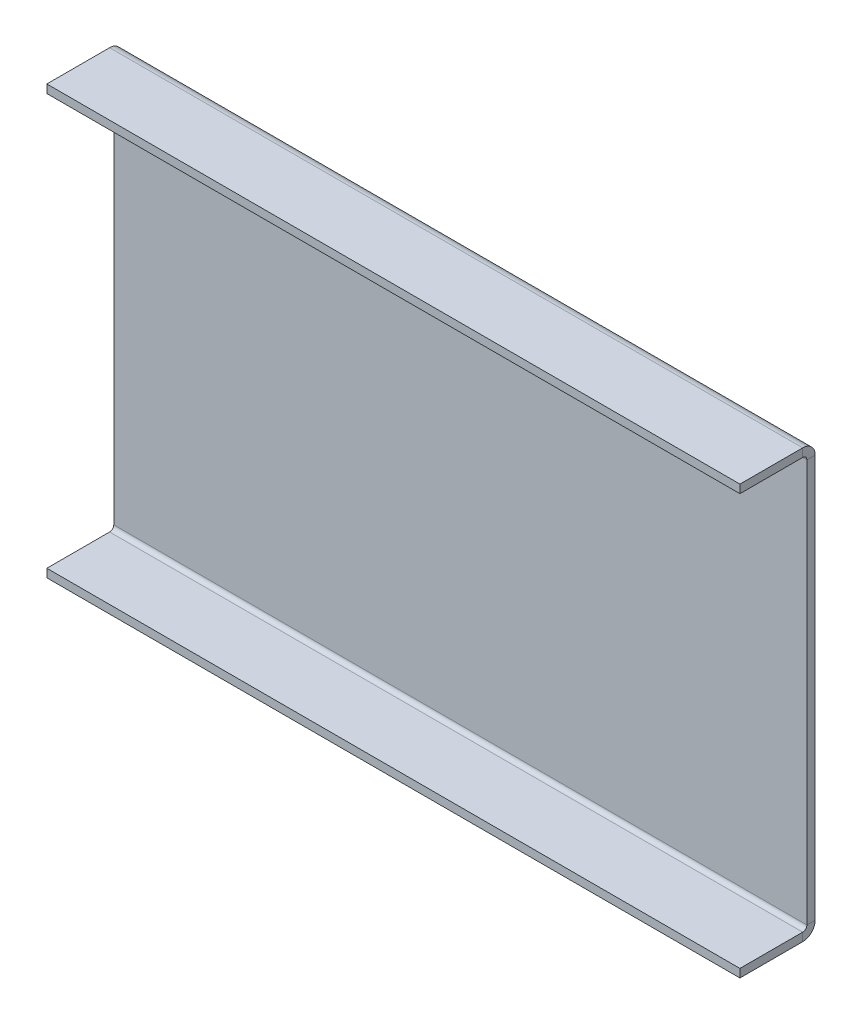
SolidWorks part; units mm, degrees
ref_plane "Plan de face" through (0, 0, 0) normal (0, 0, 1) x (1, 0, 0)
ref_plane "Plan de dessus" through (0, 0, 0) normal (0, 1, 0) x (1, 0, 0)
ref_plane "Plan de droite" through (0, 0, 0) normal (1, 0, 0) x (0, 0, -1)
sketch "Esquisse1" plane through (0, 0, 0) normal (0, 0, 1) x (1, 0, 0)
  line L1 (-80, 50) -> (420, 50)
  line L2 (-80, 50) -> (-80, -350)
  line L3 (-80, -350) -> (420, -350)
  line L4 (420, 50) -> (420, -350)
  dimension "D1" = 500
  dimension "D2" = 400
extrude "Extrusion1" add sketch "Esquisse1" along normal blind 6
sheet metal parameters "Tôlerie 2" parameters "D1"=3
flatten bends "Dépliage 2" parameters "D1"=0
sketch "Esquisse-Angle2" plane through (0, 0, 6) normal (0, 0, 1) x (1, 0, 0)
process bends "Pliage 2" parameters "D1"=5
sketch "Esquisse-Plate2" plane through (0, 0, 6) normal (0, 0, 1) x (1, 0, 0)
  line L0 (480, 0) -> (-180, 0)
  line L2 (420, 50) -> (-80, 50) construction
  line L3 (460, -300) -> (-130, -300)
  line L4 (-80, -350) -> (420, -350) construction
  point P4 (170, -100)
  dimension "D1" = 50
  dimension "D2" = 50
bend "Pli défini à plat1" bend angle 90 parameters "D1"=0, "D5"=1
bend "Pli défini à plat2" bend angle 90 parameters "D1"=0, "D5"=2
